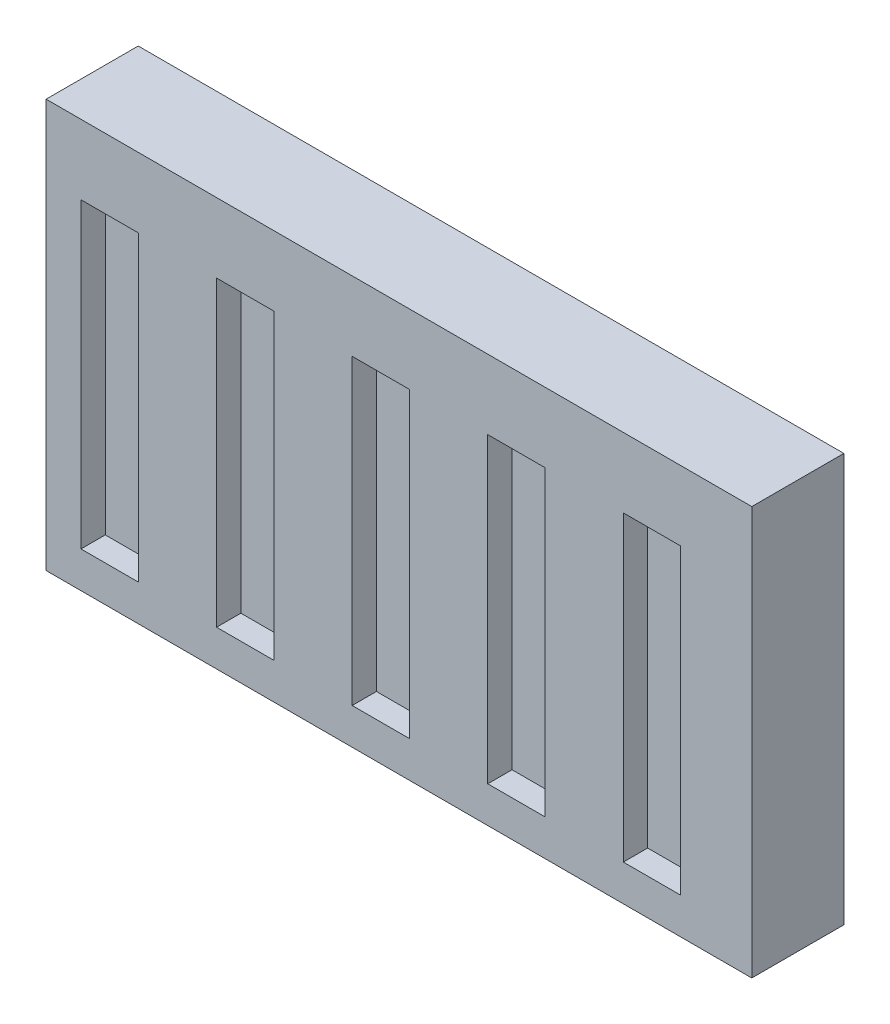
SolidWorks part; units mm, degrees
ref_plane "Front" through (0, 0, 0) normal (0, 0, 1) x (1, 0, 0)
ref_plane "Top" through (0, 0, 0) normal (0, 1, 0) x (1, 0, 0)
ref_plane "Right" through (0, 0, 0) normal (1, 0, 0) x (0, 0, -1)
sketch "Sketch1" plane through (0, 0, 0) normal (0, 0, 1) x (1, 0, 0)
  line L1 (0, 0) -> (124.9008, 0)
  line L2 (0, 0) -> (0, 72.264)
  line L3 (0, 72.264) -> (124.9008, 72.264)
  line L4 (124.9008, 0) -> (124.9008, 72.264)
extrude "Extrude1" add sketch "Sketch1" along normal blind 16.3
sketch "Sketch2" plane through (0, 0, 16.3) normal (0, 0, 1) x (1, 0, 0)
  line L0 (0, 72.264) -> (0, 0) construction
  line L1 (6.167, 6.4022) -> (16.3278, 6.4022)
  line L2 (6.167, 6.4022) -> (6.167, 59.9293)
  line L3 (6.167, 59.9293) -> (16.3278, 59.9293)
  line L4 (16.3278, 6.4022) -> (16.3278, 59.9293)
  line L5 (0, 0) -> (124.9008, 0) construction
other "AlignGroup3" parameters "D1"=0, "D2"=0, "D3"=10.1608, "D4"=53.5271, "D5"=53.5271, "D6"=10.1608
other "AlignGroup4"
extrude "Cut-Extrude1" cut sketch "Sketch2" against normal blind 4.3
pattern_linear "LPattern1" count 5 spacing 24 along (1, 0, 0) of "Cut-Extrude1"
